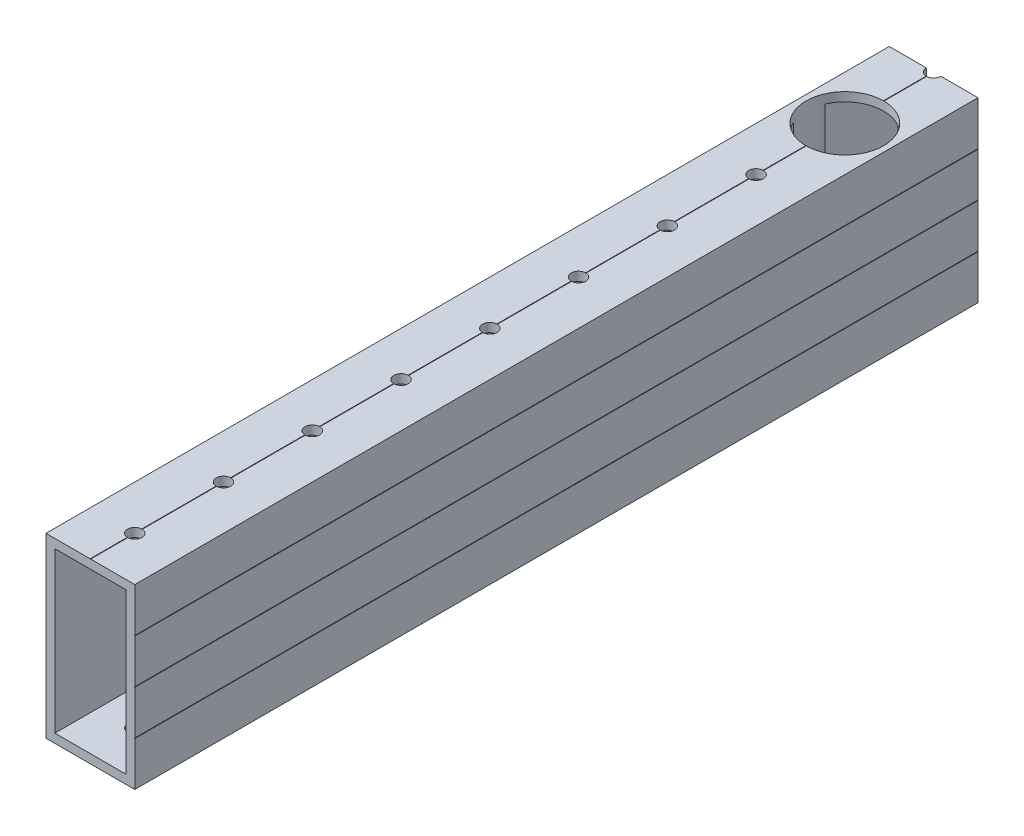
SolidWorks part; units mm, degrees
other "Cut-Extrude2"
ref_plane "Front Plane" through (0, 0, 0) normal (0, 0, 1) x (1, 0, 0)
ref_plane "Top Plane" through (0, 0, 0) normal (0, 1, 0) x (1, 0, 0)
ref_plane "Right Plane" through (0, 0, 0) normal (1, 0, 0) x (0, 0, -1)
imported_body "Imported1"
ref_plane "Plane1" through (0, 0, 508) normal (0, 0, 1) x (1, 0, 0)
other "SurfaceCut1"
sketch "Sketch1" plane through (0, 25.4, 0) normal (0, 1, 0) x (1, 0, 0)
  circle A0 centre (0, -533.4) radius 11.1125
  point P3 (0, 0)
  point P4 (0, -457.2)
  point P6 (0, 0)
  point P7 (0, 0)
  point P8 (-0.6351, -558.6217)
  point P9 (0, -558.7144)
  point P10 (0, 0)
  point P11 (0, -533.4)
  point P14 (0, 0)
  dimension "D1" = 22.225
extrude "Cut-Extrude1" cut sketch "Sketch1" against normal through all
